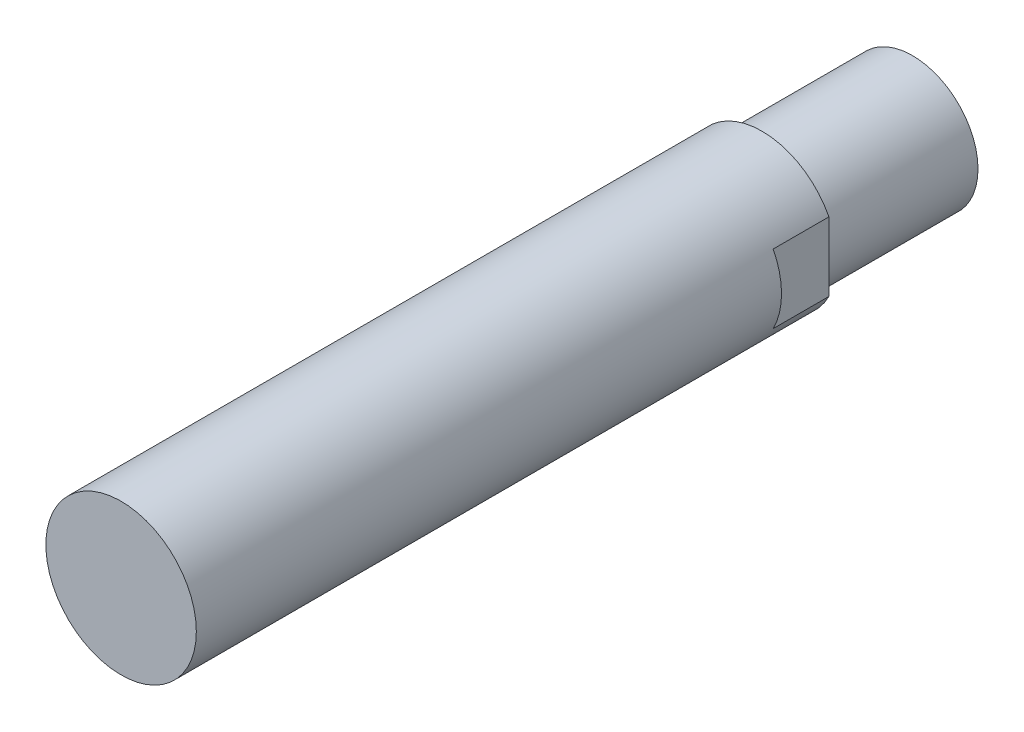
SolidWorks part; units mm, degrees
ref_plane "Plan de face" through (0, 0, 0) normal (0, 0, 1) x (1, 0, 0)
ref_plane "Plan de dessus" through (0, 0, 0) normal (0, 1, 0) x (1, 0, 0)
ref_plane "Plan de droite" through (0, 0, 0) normal (1, 0, 0) x (0, 0, -1)
sketch "Esquisse1" plane through (0, 0, 0) normal (0, 0, 1) x (1, 0, 0)
  circle A0 centre (0, 0) radius 13.5
  dimension "D1" = 27
extrude "Extrusion1" add sketch "Esquisse1" against normal blind 142
sketch "Esquisse2" plane through (0, 0, 0) normal (0, 0, 1) x (1, 0, 0)
  line L1 (-12, -13.5) -> (12, -13.5)
  line L2 (-12, -13.5) -> (-12, 13.5)
  line L3 (-12, 13.5) -> (12, 13.5)
  line L4 (12, -13.5) -> (12, 13.5)
  circle A0 centre (0, 0) radius 13.5 construction
  dimension "D1" = 24
  dimension "D2" = 12
extrude "Enlèv. mat.-Extru.1" cut sketch "Esquisse2" along normal blind 10 from offset 115 flip side to cut
sketch "Esquisse3" plane through (0, 0, 0) normal (0, 0, 1) x (1, 0, 0)
  circle A0 centre (0, 0) radius 11.75
  dimension "D1" = 23.5
extrude "Enlèv. mat.-Extru.2" cut sketch "Esquisse3" against normal through all from offset 115 flip side to cut
